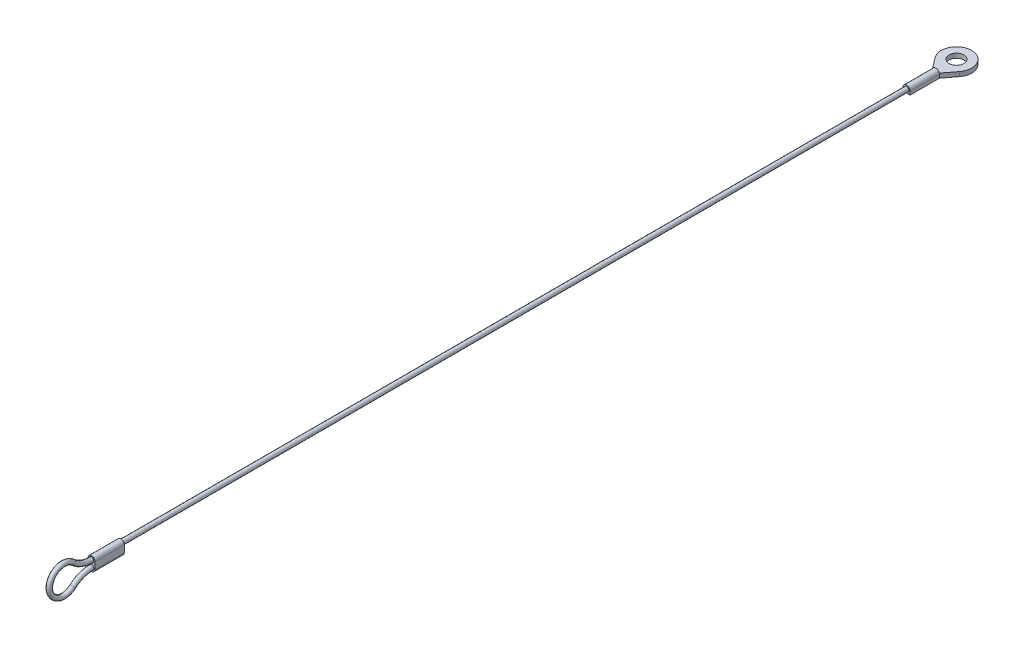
SolidWorks part; units mm, degrees
ref_plane "Front Plane" through (0, 0, 0) normal (0, 0, 1) x (1, 0, 0)
ref_plane "Top Plane" through (0, 0, 0) normal (0, 1, 0) x (1, 0, 0)
ref_plane "Right Plane" through (0, 0, 0) normal (1, 0, 0) x (0, 0, -1)
sketch "Sketch1" plane through (0, 0, 0) normal (1, 0, 0) x (0, 0, -1)
  line L2 (-278.2, 0) -> (0, 0)
  arc A0 (-278.2, 0) -> (-284.6, 2.4446) centre (-278.2, 9.6) cw
  arc A1 (-284.6, 2.4446) -> (-284.6, -4.7108) centre (-287.8, -1.1331) ccw
  arc A2 (-284.6, -4.7108) -> (-278.2, -2.2663) centre (-278.2, -11.8663) cw
  dimension "D1" = 4.8
  dimension "D4" = 9.6
  dimension "D2" = 287.8
  dimension "D3" = 9.6
sketch "Sketch2" plane through (0, 0, 0) normal (0, 0, 1) x (1, 0, 0)
  circle A0 centre (0, 0) radius 0.795
  dimension "D1" = 1.59
sweep "Sweep1" add profiles "Sketch2" path "Sketch1"
sketch "Sketch3" plane through (0, 0, 278.2) normal (0, 0, -1) x (-1, 0, 0)
  line L0 (0, 0) -> (0, -2.2663) construction
  line L1 (1.195, 0) -> (1.195, -2.2663)
  line L2 (-1.195, 0) -> (-1.195, -2.2663)
  line L3 (-0.795, -2.2663) -> (0.795, -2.2663) construction
  arc A0 (1.195, 0) -> (-1.195, 0) centre (0, 0) ccw
  arc A1 (-1.195, -2.2663) -> (1.195, -2.2663) centre (0, -2.2663) ccw
  point P3 (0, -1.1331)
  dimension "D1" = 2.39
extrude "Boss-Extrude1" add sketch "Sketch3" along normal blind 10
sketch "Sketch4" plane through (0, 0, 0) normal (0, 0, -1) x (-1, 0, 0)
  line L0 (-1.195, 0) -> (-1.195, -1.195)
  line L1 (-1.195, -1.195) -> (0, -1.195)
  line L2 (0, -1.195) -> (1.195, -1.195)
  line L3 (1.195, -1.195) -> (1.195, 0)
  arc A0 (1.195, 0) -> (-1.195, 0) centre (0, 0) ccw
  dimension "D1" = 2.39
extrude "Boss-Extrude2" add sketch "Sketch4" along normal blind 10
sketch "Sketch5" plane through (0, -1.195, 0) normal (0, -1, 0) x (1, 0, 0)
  line L0 (-1.195, -10) -> (1.195, -10)
  line L1 (1.195, -10) -> (4.1323, -13.8352)
  line L2 (-4.1323, -13.8352) -> (-1.195, -10)
  arc A0 (4.1323, -13.8352) -> (-4.1323, -13.8352) centre (0, -17) cw
  circle A1 centre (0, -17) radius 2.54
  point P8 (-5.205, -17)
  point P9 (5.205, -17)
  dimension "D1" = 5.08
  dimension "D2" = 10.41
  dimension "D3" = 17
extrude "Boss-Extrude3" add sketch "Sketch5" against normal blind 1.52
